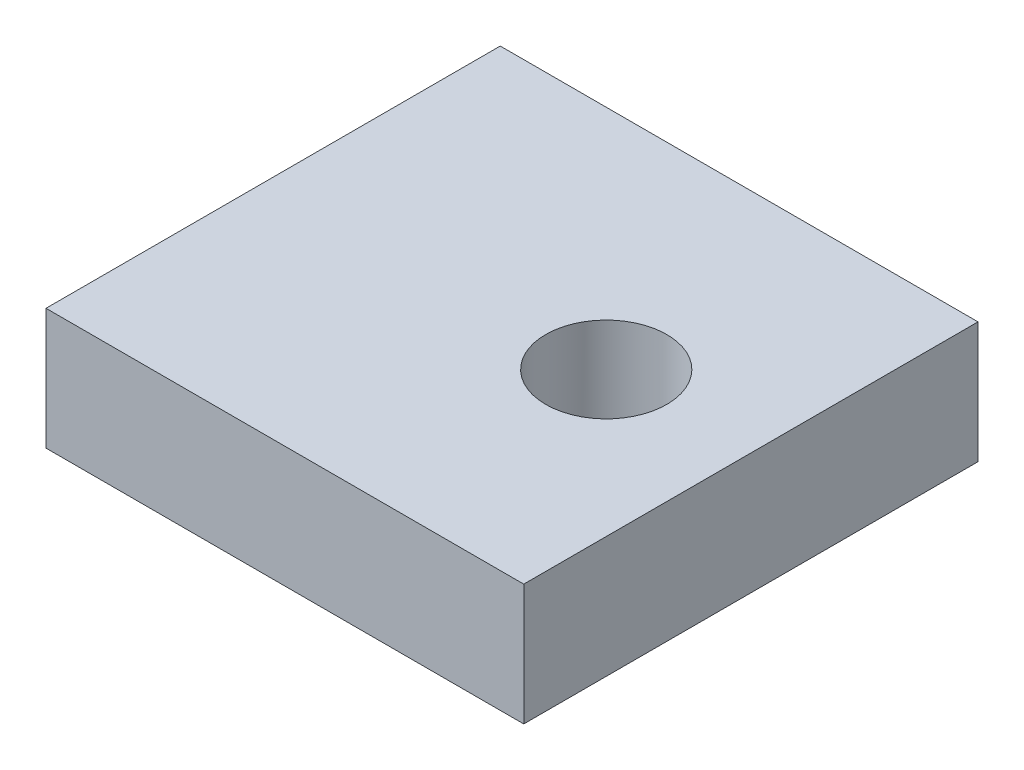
SolidWorks part; units mm, degrees
ref_plane "Ebene vorne" through (0, 0, 0) normal (0, 0, 1) x (1, 0, 0)
ref_plane "Ebene oben" through (0, 0, 0) normal (0, 1, 0) x (1, 0, 0)
ref_plane "Ebene rechts" through (0, 0, 0) normal (1, 0, 0) x (0, 0, -1)
sketch "Skizze1" plane through (0, 0, 0) normal (0, 0, 1) x (1, 0, 0)
sketch_block_instance "Block-1"
sketch_block "Block" parameters "D1"=23.2005
extrude "Linear austragen1" add sketch "Skizze1" along normal mid plane 75
sketch "Skizze2" plane through (0, 81.647, 0) normal (0, 1, 0) x (-1, 0, 0)
  line L0 (12.7603, 0) -> (-12.7603, 0) construction
  line L1 (35.9607, 37.5) -> (35.9607, -37.5) construction
  circle A0 centre (-19.0393, 0) radius 10
  point P6 (-29.0393, 0)
  dimension "D1" = 20
  dimension "D2" = 55
extrude "Schnitt-Linear austragen1" cut sketch "Skizze2" against normal blind 75
